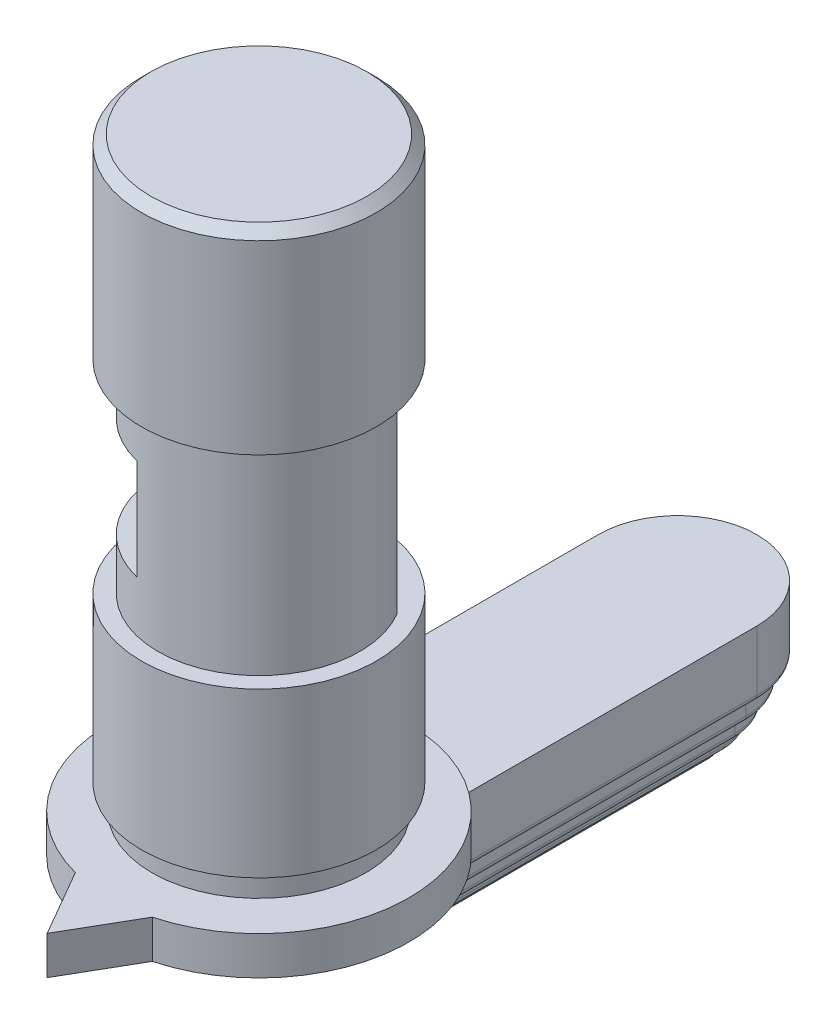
SolidWorks part; units mm, degrees
ref_plane "Front Plane" through (0, 0, 0) normal (0, 0, 1) x (1, 0, 0)
ref_plane "Top Plane" through (0, 0, 0) normal (0, 1, 0) x (1, 0, 0)
ref_plane "Right Plane" through (0, 0, 0) normal (1, 0, 0) x (0, 0, -1)
imported_body "Imported1"
sketch "Sketch1" plane through (0, 0, 3.5052) normal (0, 0, -1) x (-1, 0, 0)
  line L1 (-21.3875, 2.032) -> (-27.7375, 2.032)
  line L2 (-21.3875, 2.032) -> (-21.3875, -2.032)
  line L3 (-21.3875, -2.032) -> (-27.7375, -2.032)
  line L4 (-27.7375, 2.032) -> (-27.7375, -2.032)
  line L5 (-25.1975, 4.0957) -> (-25.1975, -4.0957) construction
  dimension "D1" = 4.064
  dimension "D2" = 6.35
  dimension "D3" = 2.54
extrude "Cut-Extrude2" cut sketch "Sketch1" against normal through all
